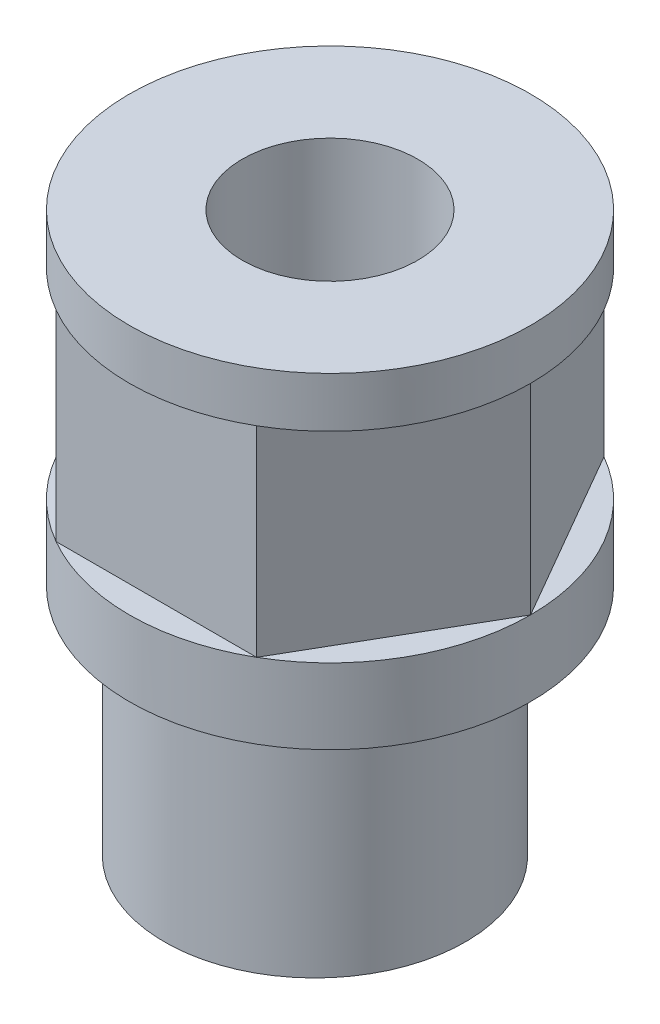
SolidWorks part; units mm, degrees
ref_plane "Front Plane" through (0, 0, 0) normal (0, 0, 1) x (1, 0, 0)
ref_plane "Top Plane" through (0, 0, 0) normal (0, 1, 0) x (1, 0, 0)
ref_plane "Right Plane" through (0, 0, 0) normal (1, 0, 0) x (0, 0, -1)
sketch "Sketch1" plane through (0, 0, 0) normal (0, 1, 0) x (1, 0, 0)
  line L1 (10.16, 0) -> (5.08, 8.7988)
  line L2 (5.08, 8.7988) -> (-5.08, 8.7988)
  line L3 (-5.08, 8.7988) -> (-10.16, 0)
  line L4 (-10.16, 0) -> (-5.08, -8.7988)
  line L5 (-5.08, -8.7988) -> (5.08, -8.7988)
  line L6 (5.08, -8.7988) -> (10.16, 0)
  circle A0 centre (0, 0) radius 8.7988 construction
  dimension "D1" = 10.16
extrude "Boss-Extrude1" add sketch "Sketch1" along normal mid plane 10.16
sketch "Sketch2" plane through (0, 5.08, 0) normal (0, 1, 0) x (1, 0, 0)
  circle A0 centre (0, 0) radius 10.16
  dimension "D1" = 20.32
extrude "Boss-Extrude2" add sketch "Sketch2" along normal blind 2.54
sketch "Sketch3" plane through (0, -5.08, 0) normal (0, -1, 0) x (1, 0, 0)
  circle A0 centre (0, 0) radius 10.16
  dimension "D1" = 20.32
extrude "Boss-Extrude3" add sketch "Sketch3" along normal blind 3.81
sketch "Sketch4" plane through (0, -8.89, 0) normal (0, -1, 0) x (1, 0, 0)
  circle A0 centre (0, 0.762) radius 7.62
  dimension "D2" = 15.24
  dimension "D1" = 0.762
extrude "Boss-Extrude4" add sketch "Sketch4" along normal blind 11.43
sketch "Sketch5" plane through (0, 7.62, 0) normal (0, 1, 0) x (1, 0, 0)
  circle A0 centre (0, 0) radius 4.445
  dimension "D1" = 8.89
extrude "Cut-Extrude1" cut sketch "Sketch5" against normal blind 31.242
